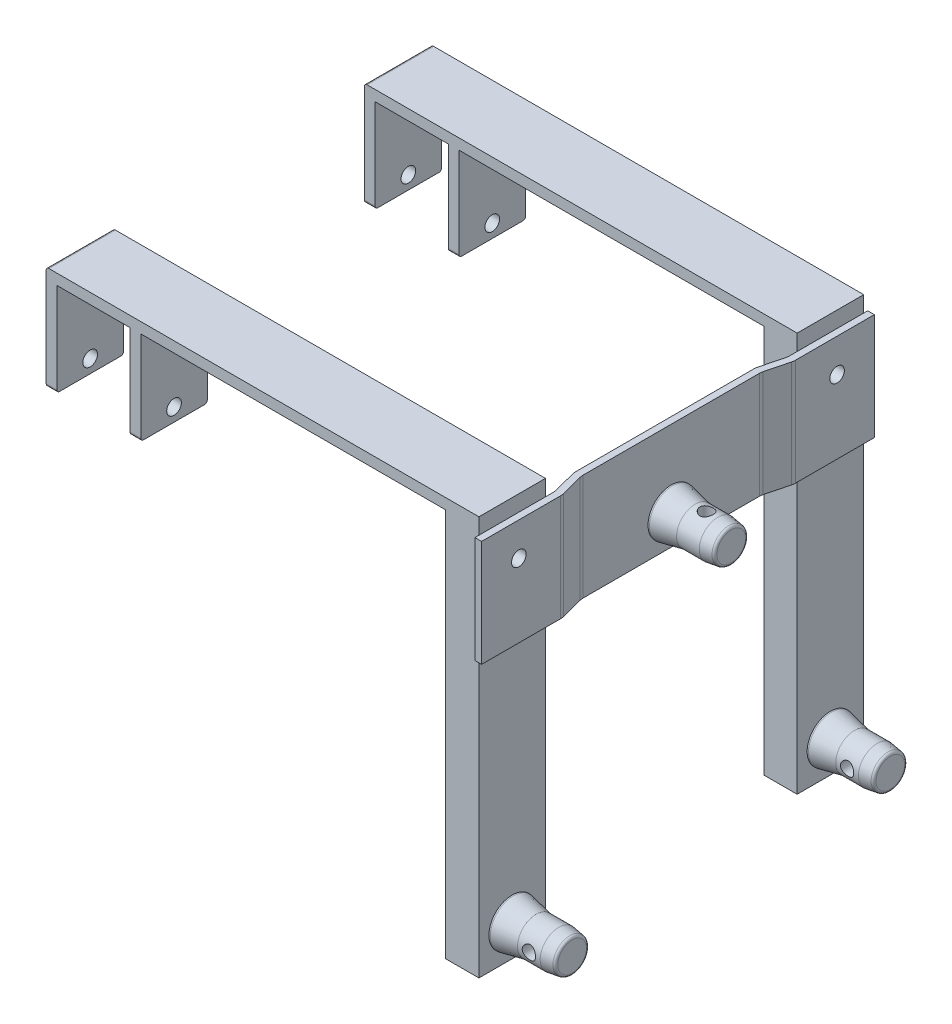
SolidWorks part; units mm, degrees
ref_plane "Face" through (0, 0, 0) normal (0, 0, 1) x (1, 0, 0)
ref_plane "Dessus" through (0, 0, 0) normal (0, 1, 0) x (1, 0, 0)
ref_plane "Droite" through (0, 0, 0) normal (1, 0, 0) x (0, 0, -1)
sketch "Esquisse1" plane through (0, 0, 0) normal (0, 0, 1) x (1, 0, 0)
  line L0 (0, 0) -> (0, 78)
  line L1 (0, 78) -> (325, 78)
  line L2 (325, 78) -> (325, 70)
  line L3 (325, 70) -> (71, 70)
  line L4 (71, 70) -> (71, 0)
  line L5 (71, 0) -> (63, 0)
  line L6 (63, 0) -> (63, 70)
  line L7 (63, 70) -> (8, 70)
  line L8 (8, 70) -> (8, 0)
  line L9 (8, 0) -> (0, 0)
  dimension "D1" = 325
  dimension "D2" = 254
  dimension "D3" = 8
  dimension "D4" = 8
  dimension "D5" = 78
  dimension "D6" = 8
extrude "Extrusion1" add sketch "Esquisse1" along normal blind 50
sketch "Esquisse2" plane through (0, 70, 0) normal (0, -1, 0) x (1, 0, 0)
  line L0 (300, 50) -> (325, 50)
  line L1 (71, 50) -> (325, 50) construction
  line L2 (325, 50) -> (325, 0)
  line L3 (325, 0) -> (300, 0)
  line L4 (71, 0) -> (325, 0) construction
  line L5 (300, 0) -> (300, 5)
  line L6 (300, 5) -> (320, 5)
  line L7 (320, 5) -> (320, 45)
  line L8 (320, 45) -> (300, 45)
  line L9 (300, 45) -> (300, 50)
  dimension "D1" = 25
  dimension "D2" = 5
  dimension "D3" = 5
extrude "Extrusion2" add sketch "Esquisse2" along normal blind 292
sketch "Esquisse3" plane through (325, 0, 0) normal (1, 0, 0) x (0, 0, -1)
  line L0 (0, -222) -> (0, 78) construction
  line L1 (0, -222) -> (-50, -222) construction
  circle A0 centre (-25, 41) radius 5.5
  circle A1 centre (-25, -198) radius 5.5
  dimension "D1" = 11
  dimension "D2" = 25
  dimension "D3" = 239
  dimension "D4" = 24
extrude "Enlèv. mat.-Extru.1" cut sketch "Esquisse3" against normal up to next
sketch "Esquisse4" plane through (71, 0, 0) normal (1, 0, 0) x (0, 0, -1)
  line L0 (0, -222) -> (0, 78) construction
  line L1 (-50, 0) -> (0, 0) construction
  circle A0 centre (-25, 10) radius 5.5
  dimension "D2" = 11
  dimension "D1" = 25
  dimension "D3" = 10
extrude "Enlèv. mat.-Extru.2" cut sketch "Esquisse4" against normal through all
fillet "Congé1" radius 2
pattern_linear "Répétition linéaire1" count 2 spacing 239
ref_plane "Plan1" through (0, 66, 0) normal (0, 1, 0) x (-1, 0, 0)
sketch "Esquisse5" plane through (0, 66, 0) normal (0, 1, 0) x (-1, 0, 0)
  line L0 (-325, 292) -> (-330, 292)
  line L1 (-330, 292) -> (-330, 231.3649)
  line L2 (-330, 231.3649) -> (-325, 212)
  line L3 (-325, 212) -> (-325, 77)
  line L4 (-325, 77) -> (-330, 57.6351)
  line L5 (-330, 57.6351) -> (-330, -3)
  line L6 (-330, -3) -> (-325, -3)
  line L7 (-325, -3) -> (-325, 57)
  line L8 (-325, 57) -> (-320, 76.3649)
  line L9 (-320, 76.3649) -> (-320, 212.6351)
  line L10 (-320, 212.6351) -> (-325, 232)
  line L11 (-325, 232) -> (-325, 292)
  line L12 (-325, 289) -> (-325, 239) construction
  line L14 (-325, 289) -> (-2, 289) construction
  dimension "D1" = 5
  dimension "D2" = 5
  dimension "D3" = 3
  dimension "D4" = 295
  dimension "D5" = 135
  dimension "D6" = 175
  dimension "D7" = 60
  dimension "D8" = 80
  dimension "D9" = 20
  dimension "D10" = 20
extrude "Extrusion3" add sketch "Esquisse5" against normal blind 80
sketch "Esquisse6" plane through (330, 0, 0) normal (1, 0, 0) x (0, 0, -1)
  circle A0 centre (-264, 41) radius 5.5 construction
  circle A1 centre (-25, 41) radius 5.5 construction
  circle A2 centre (-264, 41) radius 5.5
  circle A3 centre (-25, 41) radius 5.5
extrude "Enlèv. mat.-Extru.3" cut sketch "Esquisse6" against normal blind 5
sketch "Esquisse7" plane through (325, 0, 0) normal (1, 0, 0) x (0, 0, -1)
  line L0 (3, -14) -> (3, 66) construction
  circle A0 centre (-144.5, 9) radius 5.5
  circle A1 centre (-25, 41) radius 5.5 construction
  dimension "D2" = 147.5
  dimension "D1" = 32
extrude "Enlèv. mat.-Extru.4" cut sketch "Esquisse7" against normal blind 5
sketch "Esquisse8" plane through (325, 0, 0) normal (1, 0, 0) x (0, 0, -1)
  circle A0 centre (-144.5, 9) radius 25
  circle A1 centre (-25, -198) radius 25
  circle A2 centre (-264, -198) radius 25
  circle A3 centre (-144.5, 9) radius 5.5 construction
  circle A4 centre (-264, -198) radius 5.5 construction
  circle A5 centre (-25, -198) radius 5.5 construction
  dimension "D1" = 50
fillet "Congé2" radius 10
ref_plane "Plan2" through (0, 0, 264) normal (0, 0, 1) x (1, 0, 0)
sketch "Esquisse9" plane through (0, 0, 264) normal (0, 0, 1) x (1, 0, 0)
  line L0 (347.8715, -198) -> (292.5501, -198) construction
  line L1 (320, -198) -> (325, -198) construction
  line L2 (325, -198) -> (325, -215.5)
  line L3 (325, -215.5) -> (326, -215.5)
  line L4 (326, -215.5) -> (343, -212)
  line L5 (343, -212) -> (360, -212)
  line L6 (360, -212) -> (370, -210.5)
  line L7 (370, -210.5) -> (370, -198)
  line L8 (370, -198) -> (325, -198)
  line L9 (325, -222) -> (325, -14) construction
  dimension "D1" = 45
  dimension "D2" = 1
  dimension "D3" = 17
  dimension "D4" = 12.5
  dimension "D5" = 17.5
  dimension "D6" = 14
  dimension "D7" = 10
revolve "Révolution1" add sketch "Esquisse9" angle 360 about L0
fillet "Congé3" radius 2
pattern_linear "Répétition linéaire2" count 2 spacing 207 count 3 spacing 119.5
sketch "Esquisse10" plane through (0, 0, 289) normal (0, 0, 1) x (1, 0, 0)
  line L1 (320, -198) -> (325, -198) construction
  circle A1 centre (351.5, -198) radius 5
  dimension "D1" = 10
extrude "Enlèv. mat.-Extru.5" cut sketch "Esquisse10" against normal through all
sketch "Esquisse11" plane through (0, 78, 0) normal (0, 1, 0) x (-1, 0, 0)
  line L0 (-320, 144.5) -> (-325, 144.5) construction
  line L1 (-326, 144.5) -> (-343, 144.5) construction
  line L2 (-343, 130.5) -> (-343, 158.5) construction
  circle A0 centre (-351.5, 144.5) radius 5
  dimension "D1" = 10
  dimension "D2" = 8.5
extrude "Enlèv. mat.-Extru.6" cut sketch "Esquisse11" against normal through all
